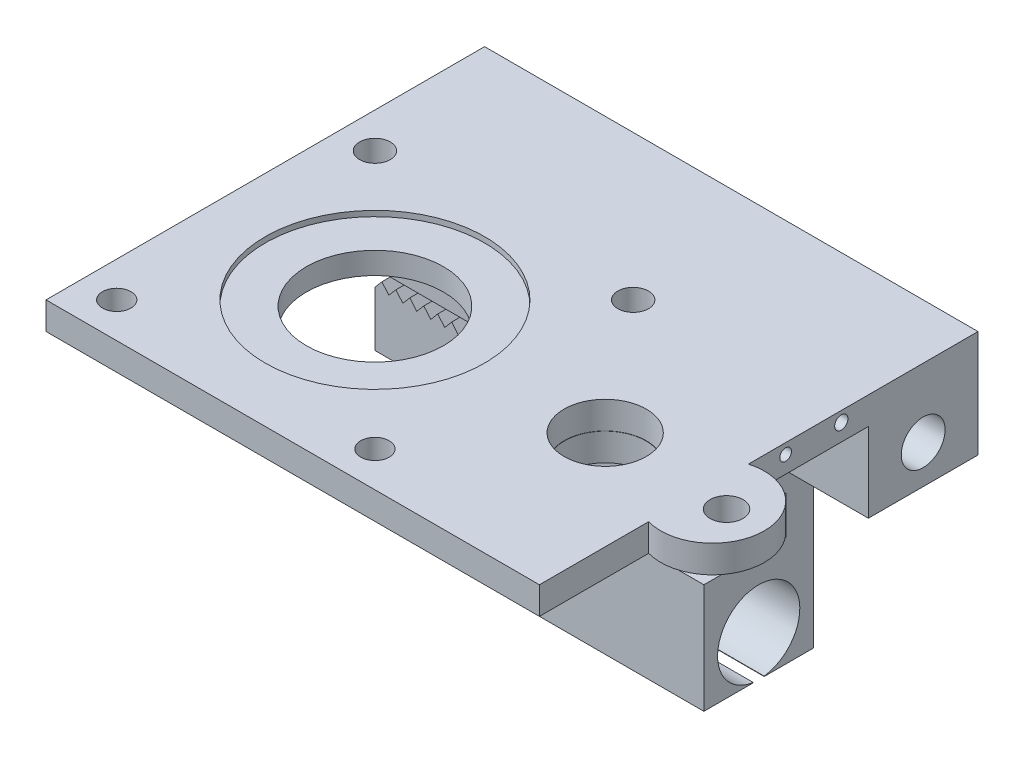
SolidWorks part; units mm, degrees
ref_plane "Alzado" through (0, 0, 0) normal (0, 0, 1) x (1, 0, 0)
ref_plane "Planta" through (0, 0, 0) normal (0, 1, 0) x (1, 0, 0)
ref_plane "Vista lateral" through (0, 0, 0) normal (1, 0, 0) x (0, 0, -1)
sketch "Croquis1" plane through (0, 0, 0) normal (0, 0, 1) x (1, 0, 0)
  line L1 (0, 0) -> (60, 0)
  line L2 (0, 0) -> (0, 60)
  line L3 (0, 60) -> (60, 60)
  line L4 (60, 0) -> (60, 60)
  dimension "D1" = 60
  dimension "D2" = 60
extrude "Saliente-Extruir1" add sketch "Croquis1" along normal blind 20
sketch "Croquis2" plane through (0, 0, 0) normal (-1, 0, 0) x (0, 0, 1)
  line L0 (5, 30) -> (0, 30) construction
  line L1 (5, 40) -> (15, 40)
  line L2 (5, 40) -> (5, 20)
  line L3 (5, 20) -> (15, 20)
  line L4 (15, 40) -> (15, 20)
  line L5 (0, 60) -> (0, 0) construction
  line L6 (10, 40) -> (10, 52.5) construction
  line L7 (10, 7.5) -> (10, 20) construction
  line L8 (15, 30) -> (20, 30) construction
  line L9 (20, 60) -> (20, 0) construction
  line L10 (9, 60) -> (9, 59.933)
  line L11 (20, 60) -> (0, 60) construction
  line L12 (11, 60) -> (11, 59.933)
  line L13 (10, 60) -> (10, 58.2439) construction
  line L14 (9, 60) -> (11, 60)
  line L15 (11, 0) -> (11, 0.067)
  line L16 (9, 0) -> (11, 0)
  line L17 (9, 0) -> (9, 0.067)
  arc A0 (9, 59.933) -> (11, 59.933) centre (10, 52.5) ccw
  arc A2 (9, 0.067) -> (11, 0.067) centre (10, 7.5) cw
extrude "Cortar-Extruir1" cut sketch "Croquis2" against normal through all
sketch "Croquis3" plane through (0, 0, 0) normal (-1, 0, 0) x (0, 0, 1)
  line L0 (20, 60) -> (20, 0) construction
  line L1 (15, 40) -> (20, 40)
  line L2 (15, 40) -> (15, 20)
  line L3 (15, 20) -> (20, 20)
  line L4 (20, 40) -> (20, 20)
  line L5 (5, 20) -> (15, 20) construction
extrude "Cortar-Extruir2" cut sketch "Croquis3" against normal through all
sketch "Croquis4" plane through (0, 0, 0) normal (-1, 0, 0) x (0, 0, 1)
  line L0 (5, 40) -> (5, 20) construction
  line L1 (5, 37) -> (20, 37)
  line L2 (5, 37) -> (5, 27)
  line L3 (5, 27) -> (20, 27)
  line L4 (20, 37) -> (20, 27)
  line L5 (20, 40) -> (5, 40) construction
  line L6 (20, 60) -> (20, 40) construction
  dimension "D1" = 3
  dimension "D2" = 10
extrude "Saliente-Extruir2" add sketch "Croquis4" against normal through all
sketch "Croquis5" plane through (0, 0, 20) normal (0, 0, 1) x (1, 0, 0)
  line L0 (60, 37) -> (0, 37) construction
  line L1 (28, 37) -> (32, 37)
  line L2 (28, 37) -> (28, 27)
  line L3 (28, 27) -> (32, 27)
  line L4 (32, 37) -> (32, 27)
  line L5 (60, 27) -> (0, 27) construction
  line L6 (28, 32) -> (0, 32) construction
  line L7 (0, 27) -> (0, 37) construction
  line L8 (32, 32) -> (60, 32) construction
  line L9 (60, 27) -> (60, 37) construction
  dimension "D1" = 4
extrude "Cortar-Extruir3" cut sketch "Croquis5" against normal up to surface (15 mm away)
sketch "Croquis6" plane through (0, 0, 20) normal (0, 0, 1) x (1, 0, 0)
  line L0 (28, 37) -> (26.7273, 38.5)
  line L1 (26.7273, 38.5) -> (25.4545, 37)
  line L2 (28, 37) -> (0, 37) construction
  line L3 (24.1818, 38.5) -> (22.9091, 37)
  line L4 (25.4545, 37) -> (24.1818, 38.5)
  line L5 (21.6364, 38.5) -> (20.3636, 37)
  line L6 (22.9091, 37) -> (21.6364, 38.5)
  line L7 (20.3636, 37) -> (19.0909, 38.5)
  line L8 (19.0909, 38.5) -> (17.8182, 37)
  line L9 (8.9091, 38.5) -> (7.6364, 37)
  line L10 (11.4545, 38.5) -> (10.1818, 37)
  line L11 (16.5455, 38.5) -> (15.2727, 37)
  line L12 (12.7273, 37) -> (11.4545, 38.5)
  line L13 (14, 38.5) -> (12.7273, 37)
  line L14 (10.1818, 37) -> (8.9091, 38.5)
  line L15 (17.8182, 37) -> (16.5455, 38.5)
  line L16 (15.2727, 37) -> (14, 38.5)
  line L17 (7.6364, 37) -> (6.3636, 38.5)
  line L18 (0, 37) -> (28, 37)
  line L19 (5.0909, 37) -> (3.8182, 38.5)
  line L20 (3.8182, 38.5) -> (2.5455, 37)
  line L21 (6.3636, 38.5) -> (5.0909, 37)
  line L22 (2.5455, 37) -> (1.2727, 38.5)
  line L23 (0, 37) -> (1.2727, 38.5)
  point P4 (0, 0)
  point P9 (0, 0)
  point P12 (9.9772, 38.5)
  point P15 (8.4265, 37)
  point P18 (6.6266, 38.8743)
  point P21 (5.7374, 37)
  point P24 (4.7638, 39.2843)
  point P27 (4.2946, 37)
  point P30 (2.5316, 39.3027)
  point P33 (2.1816, 37)
  point P34 (1.0982, 38.8424)
  point P35 (0, 0)
  point P37 (-9.0851, 37)
  point P39 (-11.7406, 37.2967)
  point P40 (-13.1086, 34.4712)
  point P42 (-14.221, 38.0033)
  point P43 (-10.9589, 38.8144)
  point P44 (26.3568, 37)
  point P45 (12.7825, 37)
  point P46 (11.026, 37)
  point P47 (11.5531, 38.5)
  point P48 (5.781, 38.5)
  point P49 (9.1923, 37)
  point P50 (10.7, 38.5)
  dimension "D1" = 1.5
extrude "Saliente-Extruir3" add sketch "Croquis6" against normal blind 15 contours L23 L22 M6 | L19 L20 L18 | L17 L21 M6 | L14 L9 M6 | L12 L10 M6 | L16 L13 M6 | L15 L11 M6 | L7 L8 M6 | L6 L5 M6 | L4 L3 M6 | L0 L1 M6
ref_plane "Plano1" through (30, 0, 0) normal (-1, 0, 0) x (0, 0, 1)
mirror "Simetría1" about plane through (30, 0, 0) normal (-1, 0, 0) of "Saliente-Extruir3"
sketch "Croquis7" plane through (0, 60, 0) normal (0, 1, 0) x (1, 0, 0)
  line L0 (60, -20) -> (60, -11) construction
  line L1 (0, 0) -> (60, 0)
  line L2 (0, 0) -> (0, -80)
  line L3 (0, -80) -> (60, -80)
  line L4 (60, 0) -> (60, -80)
  dimension "D1" = 80
extrude "Saliente-Extruir4" add sketch "Croquis7" along normal blind 5
sketch "Croquis8" plane through (0, 60, 0) normal (0, -1, 0) x (1, 0, 0)
  circle A0 centre (30, 50) radius 20
  dimension "D1" = 40
extrude "Cortar-Extruir4" cut sketch "Croquis8" along normal blind 1 from surface at -5
sketch "Croquis9" plane through (0, 60, 0) normal (0, -1, 0) x (1, 0, 0)
  circle A0 centre (30, 50) radius 12.5
  dimension "D1" = 25
extrude "Cortar-Extruir5" cut sketch "Croquis9" against normal through all
sketch "Croquis10" plane through (60, 0, 0) normal (1, 0, 0) x (0, 0, -1)
  line L0 (0, 45.4874) -> (-20, 45.5)
  line L1 (0, 0) -> (0, 65) construction
  line L2 (-20, 40) -> (-20, 60) construction
  line L3 (0, 45.5) -> (-20, 45.5) construction
  line L4 (-20, 45.5) -> (-20, 60)
  line L5 (-20, 60) -> (-80, 60)
  line L6 (-80, 60) -> (-80, 65)
  line L7 (-80, 65) -> (0, 65)
  line L8 (0, 65) -> (0, 45.4874)
  circle A0 centre (-10, 52.5) radius 4
extrude "Saliente-Extruir5" add sketch "Croquis10" along normal blind 30
sketch "Croquis11" plane through (0, 65, 0) normal (0, 1, 0) x (1, 0, 0)
  line L0 (90, 0) -> (90, -80) construction
  circle A0 centre (72, -50) radius 7.5
  point P2 (0, 0)
  dimension "D1" = 15
  dimension "D2" = 18
extrude "Cortar-Extruir6" cut sketch "Croquis11" against normal blind 35
sketch "Croquis12" plane through (0, 60, 0) normal (0, -1, 0) x (1, 0, 0)
  circle A0 centre (72, 50) radius 7.4435
  circle A1 centre (72, 50) radius 12.5
  dimension "D1" = 25
extrude "Saliente-Extruir6" add sketch "Croquis12" along normal blind 5
sketch "Croquis13" plane through (0, 65, 0) normal (0, 1, 0) x (1, 0, 0)
  line L0 (92.5467, 152) -> (92.5467, -218) construction
  line L1 (73.0754, -50.9748) -> (298.0754, -50.9748) construction
  circle A0 centre (92.5467, -50.9748) radius 9.4485
  circle A1 centre (95.1097, -50.9748) radius 3
  point P8 (94.8482, -50.9748)
  point P9 (95.1097, -50.9748)
  point P11 (98.8482, -50.9748)
  dimension "D1" = 6
extrude "Saliente-Extruir7" add sketch "Croquis13" against normal up to surface (5 mm away)
sketch "Croquis14" plane through (90, 0, 0) normal (1, 0, 0) x (0, 0, -1)
  circle A0 centre (-35.09, 63.1083) radius 1.0686
  circle A1 centre (-24.9303, 63.1083) radius 1.211
extrude "Cortar-Extruir7" cut sketch "Croquis14" against normal blind 5
sketch "Croquis15" plane through (0, 65, 0) normal (0, 1, 0) x (1, 0, 0)
  circle A0 centre (6.45, -26.45) radius 2.8
  circle A1 centre (53.55, -26.45) radius 2.8
  circle A2 centre (6.45, -73.55) radius 2.6
  circle A3 centre (53.55, -73.55) radius 2.6
  circle A4 centre (6.45, -26.45) radius 2.8 construction
  circle A5 centre (53.55, -26.45) radius 2.8 construction
  circle A6 centre (53.55, -73.55) radius 2.6 construction
  circle A7 centre (6.45, -73.55) radius 2.6 construction
  point P14 (53.55, -26.45)
  point P15 (53.55, -19.9962)
  point P20 (4.7913, -73.7473)
extrude "Cortar-Extruir8" cut sketch "Croquis15" against normal blind 20
equation "\"D7@Croquis2\"=\"D6@Croquis2\"/2"
